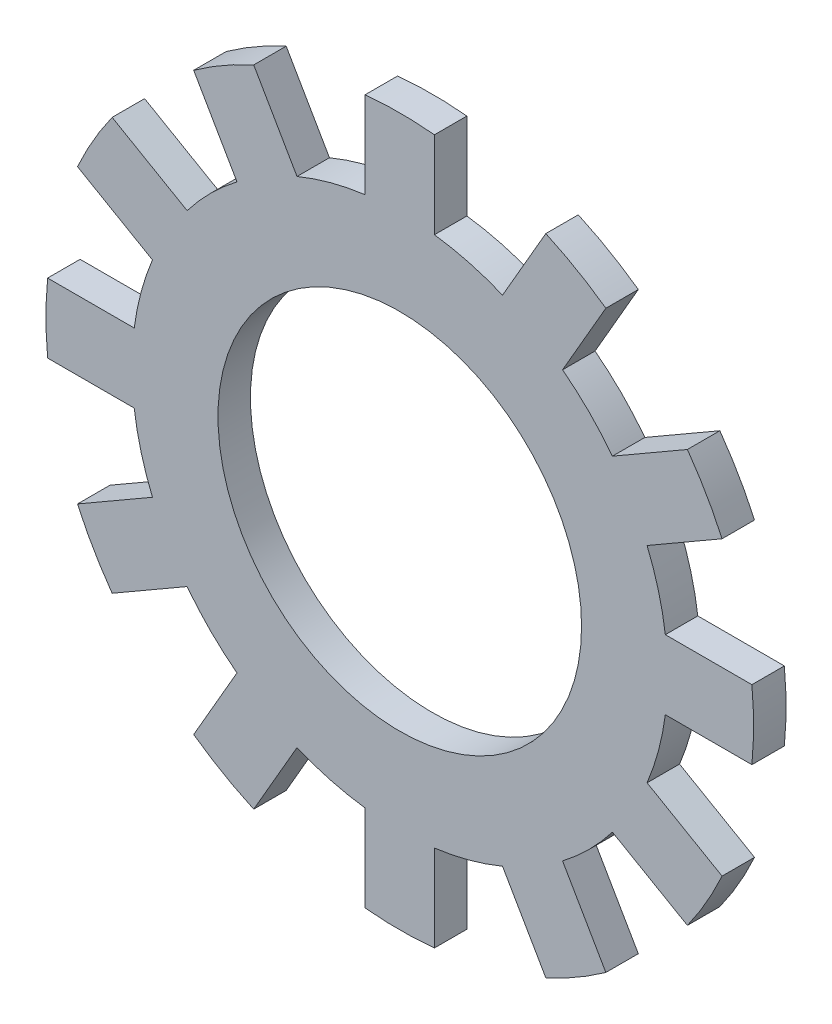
SolidWorks part; units mm, degrees
ref_plane "Front Plane" through (0, 0, 0) normal (0, 0, 1) x (1, 0, 0)
ref_plane "Top Plane" through (0, 0, 0) normal (0, 1, 0) x (1, 0, 0)
ref_plane "Right Plane" through (0, 0, 0) normal (1, 0, 0) x (0, 0, -1)
sketch "Sketch1" plane through (0, 0, 0) normal (0, 0, 1) x (1, 0, 0)
  circle A0 centre (0, 0) radius 2.725 construction
  circle A1 centre (0, 0) radius 1.4
  circle A2 centre (0, 0) radius 2.0625
  dimension "D1" = 4.125
  dimension "A" = 2.8
  dimension "B" = 5.45
extrude "Extrude1" add sketch "Sketch1" along normal blind 0.25
sketch "Sketch2" plane through (0, 0, 0) normal (0, 0, 1) x (1, 0, 0)
  line L0 (0, 0) -> (0, 2.725) construction
  line L1 (0, 0) -> (0.7053, 2.6321) construction
  line L2 (0, 0) -> (-0.7053, 2.6321) construction
  line L3 (-0.5338, 1.9922) -> (0, 1.9922) construction
  line L4 (-0.2669, 2.7119) -> (-0.2669, 2.0452)
  line L5 (0.2669, 2.7119) -> (0.2669, 2.0452)
  line L6 (-0.2669, 2.0452) -> (0.2669, 2.0452)
  circle A0 centre (0, 0) radius 2.0625 construction
  circle A1 centre (0, 0) radius 2.0625 construction
  circle A2 centre (0, 0) radius 2.725 construction
  arc A3 (0.2669, 2.7119) -> (-0.2669, 2.7119) centre (0, 0) ccw
  dimension "D2" = 15
  dimension "D3" = 15
extrude "Extrude2" add sketch "Sketch2" along normal up to surface (0.25 mm away)
pattern_circular "CirPattern1" count 12 over 360 about axis through (0, 0, 0) along (0, 0, 1) of "Extrude2"
sketch "Sketch3" plane through (0, 0, 0) normal (0, 0, 1) x (1, 0, 0)
  line L0 (-0.3187, 2.7063) -> (-0.3187, 2.0377)
  line L1 (0.3187, 2.7063) -> (0.3187, 2.0377)
  line L2 (0, 0) -> (0, 2.725) construction
  line L3 (0, 0) -> (0.8421, 2.5916) construction
  line L4 (0, 0) -> (-0.8421, 2.5916) construction
  line L5 (-0.6373, 1.9616) -> (0, 1.9616) construction
  line L6 (-0.3187, 2.0377) -> (0.3187, 2.0377)
  circle A0 centre (0, 0) radius 2.725 construction
  circle A1 centre (0, 0) radius 2.0625 construction
  circle A2 centre (0, 0) radius 2.0625 construction
  arc A3 (0.3187, 2.7063) -> (-0.3187, 2.7063) centre (0, 0) ccw
  dimension "D2" = 18
  dimension "D3" = 18
extrude "Extrude3" [suppressed] add sketch "Sketch3" along normal up to surface (0.25 mm away)
pattern_circular "CirPattern2" [suppressed] count 10 over 360
equation "\"D1@Sketch1\" =  ( \"B@Sketch1\" + \"A@Sketch1\" )  / 2"
